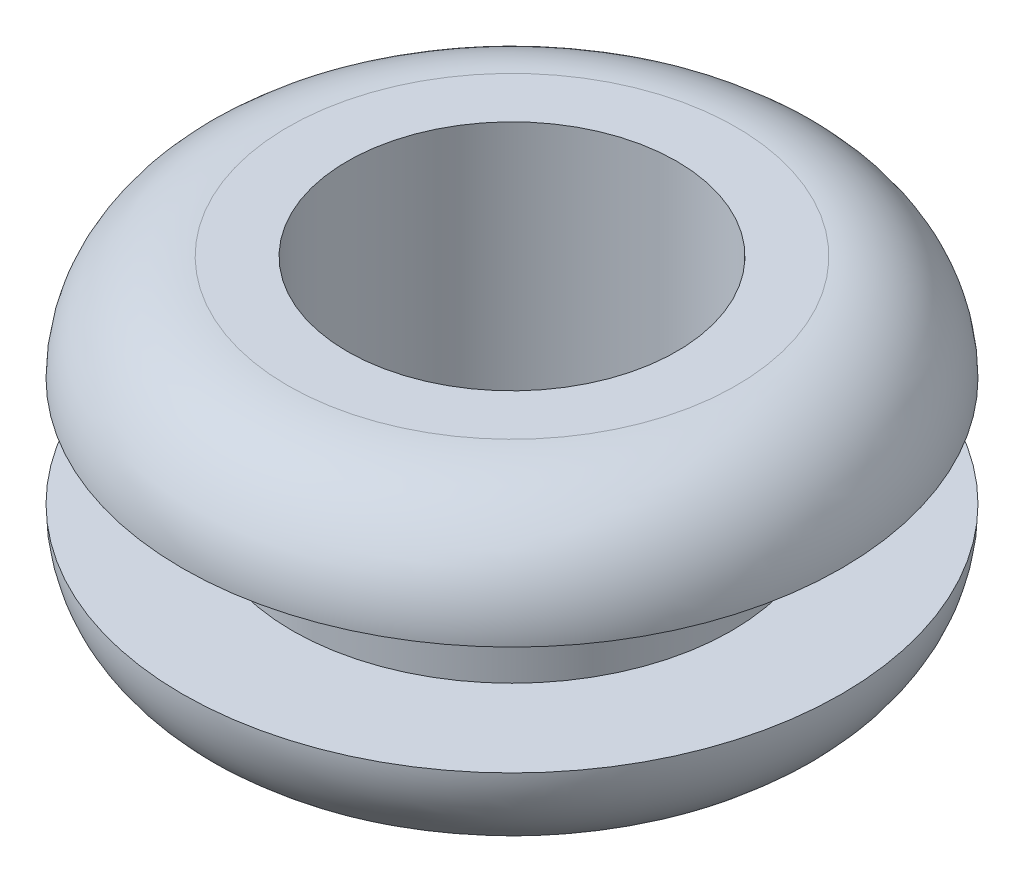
SolidWorks part; units mm, degrees
ref_plane "Front Plane" through (0, 0, 0) normal (0, 0, 1) x (1, 0, 0)
ref_plane "Top Plane" through (0, 0, 0) normal (0, 1, 0) x (1, 0, 0)
ref_plane "Right Plane" through (0, 0, 0) normal (1, 0, 0) x (0, 0, -1)
sketch "Sketch1" plane through (0, 0, 0) normal (1, 0, 0) x (0, 0, -1)
  line L0 (0, 0) -> (2.3813, 0) construction
  line L1 (0, 0) -> (0, 7.0264) construction
  line L2 (4.7625, -2.3114) -> (0, -2.3114)
  line L3 (4.7625, -2.3114) -> (4.7625, 2.3114)
  line L4 (4.7625, 2.3114) -> (0, 2.3114)
  line L5 (0, -2.3114) -> (0, 2.3114)
  line L6 (4.7625, -2.3114) -> (0, 2.3114) construction
  line L7 (4.7625, 2.3114) -> (0, -2.3114) construction
  dimension "D1" = 9.525
  dimension "D2" = 4.6228
revolve "Revolve1" add sketch "Sketch1" angle 360 about L1
fillet "Fillet1" radius 1.524 2 edges at (0, -2.3114, -4.7625) (0, 2.3114, -4.7625)
sketch "Sketch2" plane through (0, 0, 0) normal (1, 0, 0) x (0, 0, -1)
  line L0 (0, 0) -> (6.9784, 0) construction
  line L1 (4.7625, -0.7874) -> (4.7625, 0.7874) construction
  line L2 (3.175, -0.7874) -> (4.7625, -0.7874)
  line L3 (3.175, -0.7874) -> (3.175, 0.7874)
  line L4 (3.175, 0.7874) -> (4.7625, 0.7874)
  line L5 (4.7625, -0.7874) -> (4.7625, 0.7874)
  line L6 (3.175, -0.7874) -> (4.7625, 0.7874) construction
  line L7 (3.175, 0.7874) -> (4.7625, -0.7874) construction
  line L8 (0, 0) -> (0, 3.9986) construction
  point P3 (3.9688, 0)
  dimension "D1" = 1.5748
  dimension "D2" = 3.175
revolve "Cut-Revolve1" cut sketch "Sketch2" angle 360 about L8
sketch "Sketch3" plane through (0, 2.3114, 0) normal (0, 1, 0) x (1, 0, 0)
  circle A0 centre (0, 0) radius 2.3813
  dimension "D1" = 4.7625
extrude "Cut-Extrude1" cut sketch "Sketch3" against normal through all
